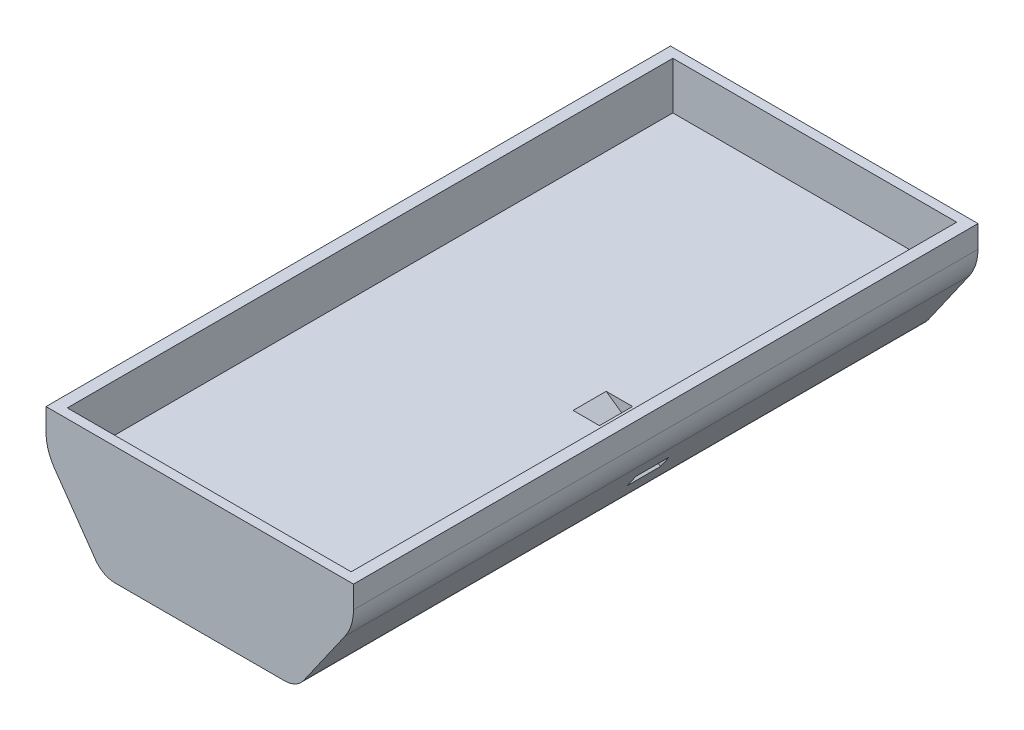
SolidWorks part; units mm, degrees
ref_plane "Front Plane" through (0, 0, 0) normal (0, 0, 1) x (1, 0, 0)
ref_plane "Top Plane" through (0, 0, 0) normal (0, 1, 0) x (1, 0, 0)
ref_plane "Right Plane" through (0, 0, 0) normal (1, 0, 0) x (0, 0, -1)
sketch "Sketch2" plane through (0, 0, 0) normal (0, 0, 1) x (1, 0, 0)
  line L1 (0, 0) -> (65, 0)
  line L2 (0, 0) -> (0, 30)
  line L3 (0, 30) -> (65, 30)
  line L4 (65, 0) -> (65, 30)
  dimension "D1" = 65
  dimension "D2" = 30
extrude "Boss-Extrude1" add sketch "Sketch2" along normal blind 132
chamfer "Chamfer1" distance 12 angle 55 1 edges at (65, 0, 66)
fillet "Fillet1" radius 10 1 edges at (65, 17.1378, 66)
chamfer "Chamfer3" distance 12 angle 55 1 edges at (0, 0, 66)
fillet "Fillet2" radius 10 1 edges at (0, 17.1378, 66)
fillet "Fillet3" radius 5 1 edges at (65, 30, 66)
fillet "Fillet4" radius 5 1 edges at (0, 30, 66)
fillet "Fillet6" radius 5 2 edges at (12, 0, 66) (53, 0, 66)
sketch "Sketch3" plane through (0, 30, 0) normal (0, 1, 0) x (1, 0, 0)
  line L1 (0, 0) -> (65, 0)
  line L2 (0, 0) -> (0, -132)
  line L3 (0, -132) -> (65, -132)
  line L4 (65, 0) -> (65, -132)
extrude "Cut-Extrude1" cut sketch "Sketch3" against normal blind 5
sketch "Sketch5" plane through (0, 0, 0) normal (0, 0, -1) x (-1, 0, 0)
  line L0 (-65, 25) -> (0, 25) construction
  line L1 (0, 25) -> (0, 20.2908) construction
  circle A0 centre (-32.5, 19) radius 2.5
  dimension "D1" = 5
  dimension "D3" = 32.5
  dimension "D2" = 6
extrude "Boss-Extrude2" add sketch "Sketch5" along normal blind 2.5
fillet "Fillet8" radius 2.5 1 edges at (30, 19, -2.5)
sketch "Sketch7" plane through (0, 0, 0) normal (0, 0, -1) x (-1, 0, 0)
  line L0 (0, 25) -> (0, 20.2908) construction
  circle A0 centre (-32.5, 13) radius 2.5
  circle A1 centre (-32.5, 19) radius 2.5 construction
  dimension "D1" = 6
  dimension "D2" = 5
  dimension "D3" = 32.5
extrude "Boss-Extrude3" add sketch "Sketch7" along normal blind 2.5
fillet "Fillet9" radius 2.5 1 edges at (30, 13, -2.5)
sketch "Sketch8" plane through (35.5635, -24.9019, 0) normal (0.8192, -0.5736, 0) x (0, 0, -1)
  line L0 (0, 48.1679) -> (0, 33.0024) construction
  line L1 (-67, 42.1066) -> (-60, 42.1066)
  line L2 (-67, 42.1066) -> (-67, 38.9066)
  line L3 (-67, 38.9066) -> (-60, 38.9066)
  line L4 (-60, 42.1066) -> (-60, 38.9066)
  line L5 (0, 28.9066) -> (-132, 28.9066) construction
  dimension "D1" = 7
  dimension "D2" = 3.2
  dimension "D3" = 60
  dimension "D4" = 10
extrude "Cut-Extrude2" cut sketch "Sketch8" against normal blind 20
sketch "Sketch9" plane through (0, 25, 0) normal (0, 1, 0) x (1, 0, 0)
  line L0 (65, 0) -> (65, -132) construction
  line L1 (2.5, -2) -> (62.5, -2)
  line L2 (2.5, -2) -> (2.5, -130)
  line L3 (2.5, -130) -> (62.5, -130)
  line L4 (62.5, -2) -> (62.5, -130)
  line L5 (0, -132) -> (65, -132) construction
  dimension "D1" = 128
  dimension "D2" = 60
  dimension "D3" = 2.5
  dimension "D4" = 2
extrude "Cut-Extrude3" cut sketch "Sketch9" against normal blind 10
